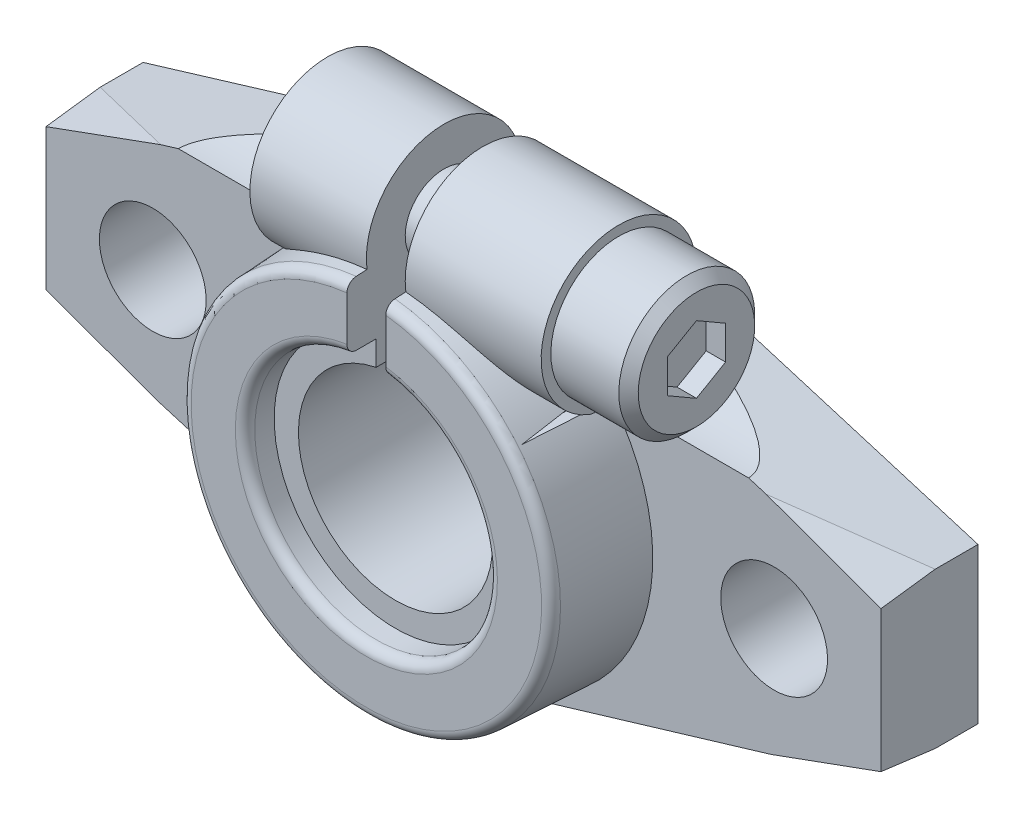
SolidWorks part; units mm, degrees
other "Solid1"
ref_plane "Front Plane" through (0, 0, 0) normal (0, 0, 1) x (1, 0, 0)
ref_plane "Top Plane" through (0, 0, 0) normal (0, 1, 0) x (1, 0, 0)
ref_plane "Right Plane" through (0, 0, 0) normal (1, 0, 0) x (0, 0, -1)
imported_body "2.7119 SHF10.stp<1>"
fillet "Fillet1" radius 0.5
